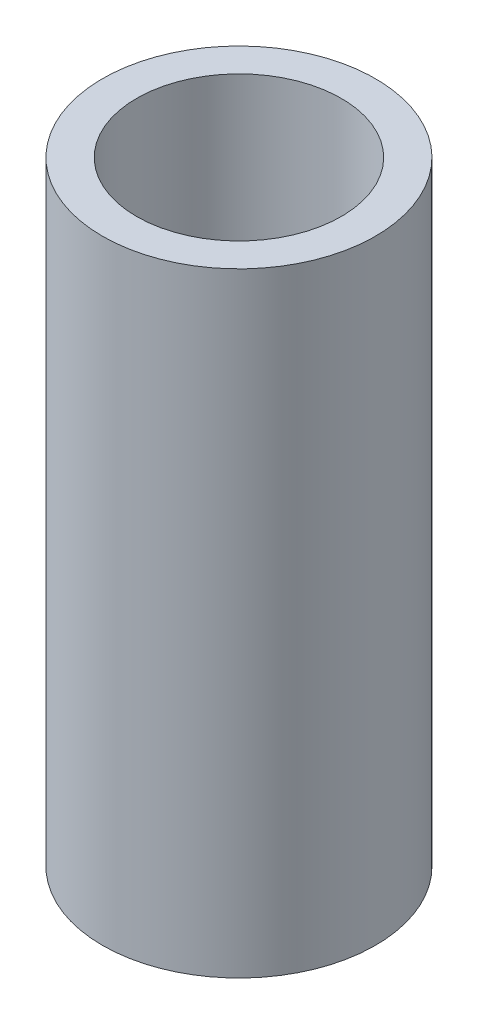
SolidWorks part; units mm, degrees
ref_plane "Front Plane" through (0, 0, 0) normal (0, 0, 1) x (1, 0, 0)
ref_plane "Top Plane" through (0, 0, 0) normal (0, 1, 0) x (1, 0, 0)
ref_plane "Right Plane" through (0, 0, 0) normal (1, 0, 0) x (0, 0, -1)
sketch "Sketch1" plane through (0, 0, 0) normal (0, 1, 0) x (1, 0, 0)
  circle A0 centre (0, 0) radius 1.5
  circle A1 centre (0, 0) radius 2
  dimension "D1" = 3
  dimension "D2" = 4
extrude "Boss-Extrude1" add sketch "Sketch1" along normal blind 9
sketch "Sketch2" plane through (0, 0, 0) normal (0, -1, 0) x (1, 0, 0)
  line L0 (0, 0) -> (0, 2) construction
  circle A0 centre (0, 0) radius 2 construction
